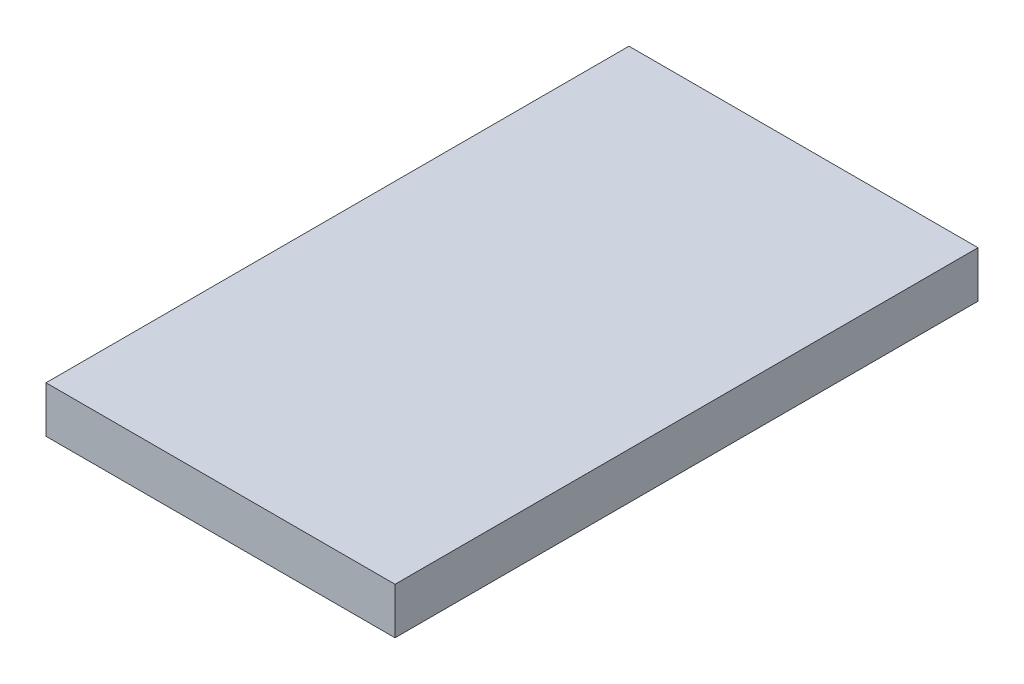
SolidWorks part; units mm, degrees
ref_plane "Front Plane" through (0, 0, 0) normal (0, 0, 1) x (1, 0, 0)
ref_plane "Top Plane" through (0, 0, 0) normal (0, 1, 0) x (1, 0, 0)
ref_plane "Right Plane" through (0, 0, 0) normal (1, 0, 0) x (0, 0, -1)
sketch "Sketch1" plane through (0, 0, 0) normal (0, 1, 0) x (1, 0, 0)
  line L1 (-60.2, 100.55) -> (60.2, 100.55)
  line L2 (-60.2, 100.55) -> (-60.2, -100.55)
  line L3 (-60.2, -100.55) -> (60.2, -100.55)
  line L4 (60.2, 100.55) -> (60.2, -100.55)
  line L5 (-60.2, 100.55) -> (60.2, -100.55) construction
  line L6 (-60.2, -100.55) -> (60.2, 100.55) construction
  point P0 (0, 0)
  dimension "D1" = 120.4
  dimension "D2" = 201.1
extrude "Boss-Extrude1" add sketch "Sketch1" along normal blind 16
sketch "Sketch2" plane through (0, 0, 0) normal (0, -1, 0) x (1, 0, 0)
  line L2 (-35, 50.85) -> (35, 50.85) construction
  line L3 (-35, 50.85) -> (-35, -50.85) construction
  line L4 (-35, -50.85) -> (35, -50.85) construction
  line L5 (35, 50.85) -> (35, -50.85) construction
  line L6 (-35, 50.85) -> (35, -50.85) construction
  line L7 (-35, -50.85) -> (35, 50.85) construction
  circle A0 centre (-35, 50.85) radius 3.1
  circle A1 centre (35, 50.85) radius 3.1
  circle A2 centre (35, -50.85) radius 3.1
  circle A3 centre (-35, -50.85) radius 3.1
  point P0 (0, 0)
  dimension "D2" = 0
  dimension "D1" = 6.2
  dimension "D3" = 70
  dimension "D4" = 101.7
extrude "Cut-Extrude1" cut sketch "Sketch2" against normal blind 5
chamfer "Chamfer1" [suppressed] distance 12 angle 45
